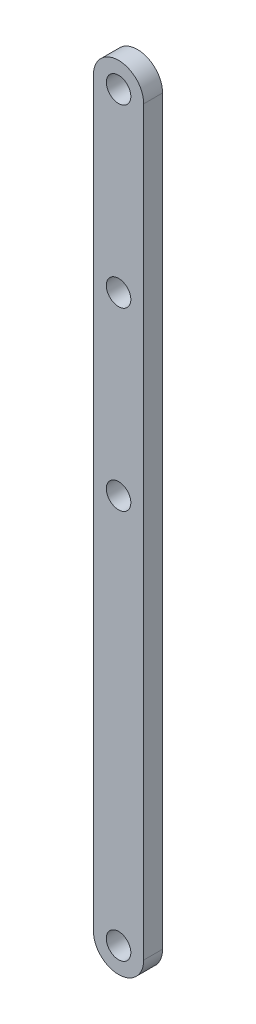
SolidWorks part; units mm, degrees
ref_plane "前视基准面" through (0, 0, 0) normal (0, 0, 1) x (1, 0, 0)
ref_plane "上视基准面" through (0, 0, 0) normal (0, 1, 0) x (1, 0, 0)
ref_plane "右视基准面" through (0, 0, 0) normal (1, 0, 0) x (0, 0, -1)
sketch "草图1" plane through (0, 0, 0) normal (0, 0, 1) x (1, 0, 0)
  line L0 (0, 0) -> (0, 118) construction
  line L1 (-4, 0) -> (-4, 118)
  line L2 (4, 0) -> (4, 118)
  arc A0 (-4, 0) -> (4, 0) centre (0, 0) ccw
  arc A1 (4, 118) -> (-4, 118) centre (0, 118) ccw
  point P3 (0, 59)
  dimension "D2" = 4
  dimension "D1" = 118
extrude "凸台-拉伸1" add sketch "草图1" along normal blind 3
hole_wizard "Ø3.9 (3.9) 直径孔1" positions "草图2" profile "草图3" hole size "Ø3.9" standard "GB"
sketch "草图2" plane through (0, 0, 3) normal (0, 0, 1) x (1, 0, 0)
  line L0 (0, 118) -> (0, 0) construction
  point P0 (0, 118)
  point P3 (0, 0)
  point P6 (0, 62)
  point P14 (0, 90)
  dimension "D1" = 28
  dimension "D2" = 28
sketch "草图3" plane through (0, 118, 3) normal (1, 0, 0) x (0, -1, 0)
  line L0 (0, 0) -> (0, 3)
  line L1 (0, 3) -> (1.95, 3)
  line L2 (1.95, 3) -> (1.95, 0)
  line L5 (1.95, 0) -> (0, 0)
  line L11 (0, -6.35) -> (0, 107.95) construction
  dimension "通孔孔直径" = 3.9
  dimension "通孔孔深度" = 3
